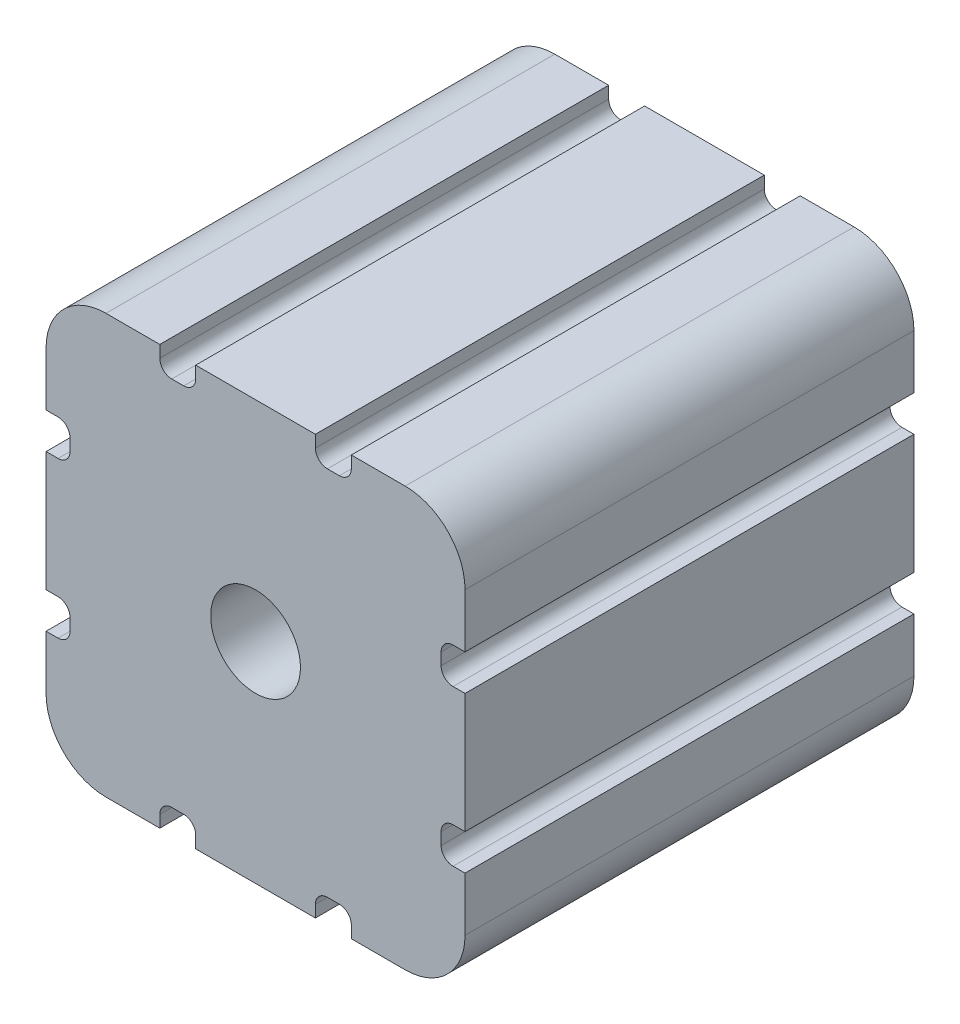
SolidWorks part; units mm, degrees
ref_plane "Face" through (0, 0, 0) normal (0, 0, 1) x (1, 0, 0)
ref_plane "Dessus" through (0, 0, 0) normal (0, 1, 0) x (1, 0, 0)
ref_plane "Droite" through (0, 0, 0) normal (1, 0, 0) x (0, 0, -1)
sketch "Esquisse1" plane through (0, 0, 0) normal (0, 0, 1) x (1, 0, 0)
  line L1 (0, 0) -> (70, 0)
  line L2 (0, 0) -> (0, 70)
  line L3 (0, 70) -> (70, 70)
  line L4 (70, 0) -> (70, 70)
  dimension "D1" = 70
extrude "Base-Extrusion" add sketch "Esquisse1" along normal blind 75
sketch "Esquisse2" plane through (0, 0, 75) normal (0, 0, 1) x (1, 0, 0)
  line L0 (70, 70) -> (0, 0) construction
  circle A0 centre (35, 35) radius 7.5
  dimension "D1" = 15
extrude "Enlèv. mat.-Extru.1" cut sketch "Esquisse2" against normal blind 67
fillet "Congé1" radius 10
sketch "Esquisse3" plane through (0, 0, 75) normal (0, 0, 1) x (1, 0, 0)
  line L0 (35, 35) -> (35, 75.2109) construction
  line L1 (60, 70) -> (10, 70) construction
  line L2 (19, 70) -> (25, 70)
  line L3 (19, 70) -> (19, 68)
  line L4 (21, 66) -> (23, 66)
  line L5 (25, 70) -> (25, 68)
  line L6 (45, 70) -> (45, 68)
  line L7 (49, 66) -> (47, 66)
  line L8 (51, 70) -> (51, 68)
  line L9 (51, 70) -> (45, 70)
  circle A0 centre (35, 35) radius 7.5 construction
  arc A1 (19, 68) -> (21, 66) centre (21, 68) ccw
  arc A2 (25, 68) -> (23, 66) centre (23, 68) cw
  arc A3 (45, 68) -> (47, 66) centre (47, 68) ccw
  arc A4 (51, 68) -> (49, 66) centre (49, 68) cw
  dimension "D4" = 2
  dimension "D1" = 6
  dimension "D2" = 10
  dimension "D3" = 4
extrude "Enlèv. mat.-Extru.2" cut sketch "Esquisse3" against normal through all
pattern_circular "Répétition circulaire1" count 4 over 360
